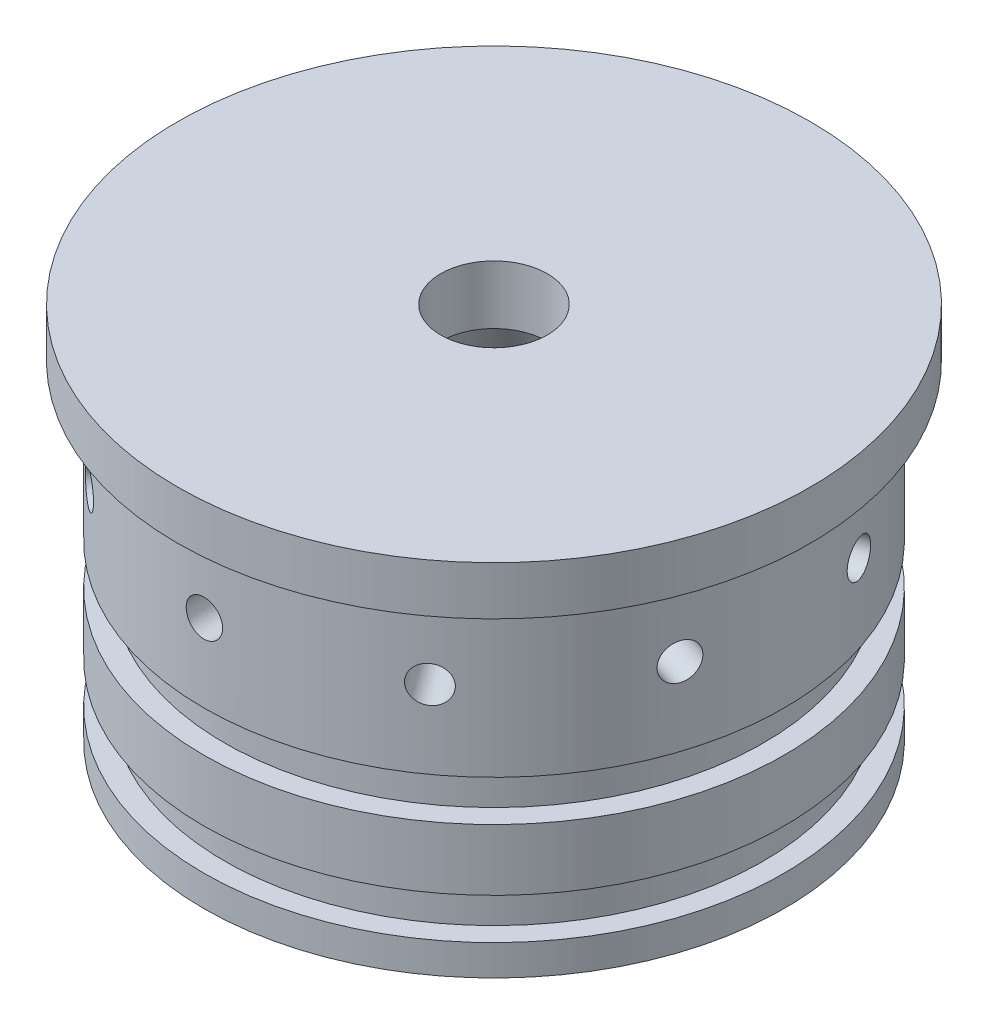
SolidWorks part; units mm, degrees
ref_plane "Front Plane" through (0, 0, 0) normal (0, 0, 1) x (1, 0, 0)
ref_plane "Top Plane" through (0, 0, 0) normal (0, 1, 0) x (1, 0, 0)
ref_plane "Right Plane" through (0, 0, 0) normal (1, 0, 0) x (0, 0, -1)
sketch "Sketch1" plane through (0, 0, 0) normal (0, 0, 1) x (1, 0, 0)
  line L0 (0, 0) -> (0, 39.8554) construction
  line L1 (26.7335, 0) -> (37.846, 0)
  line L2 (37.846, 0) -> (37.846, 4)
  line L4 (37.846, 13.334) -> (37.846, 17.334)
  line L5 (37.846, 42.988) -> (41.275, 42.988)
  line L6 (41.275, 42.988) -> (41.275, 49.338)
  line L7 (41.275, 49.338) -> (6.9453, 49.338)
  line L8 (0, 49.338) -> (0, 39.8554)
  line L9 (37.846, 0) -> (37.846, 4)
  line L10 (37.846, 4) -> (35.1282, 4)
  line L11 (35.1282, 4) -> (35.1282, 9.334)
  line L12 (35.1282, 9.334) -> (37.846, 9.334)
  line L13 (37.846, 9.334) -> (37.846, 13.334)
  line L14 (37.846, 13.334) -> (37.846, 17.334)
  line L15 (37.846, 17.334) -> (35.1282, 17.334)
  line L16 (35.1282, 17.334) -> (35.1282, 22.668)
  line L17 (35.1282, 22.668) -> (37.846, 22.668)
  line L18 (37.846, 22.668) -> (37.846, 42.988)
  line L19 (37.846, 0) -> (26.7335, 0)
  line L20 (26.7335, 0) -> (26.7335, 12.7)
  line L22 (26.7335, 12.7) -> (20.3835, 12.7)
  line L24 (6.9453, 49.338) -> (6.9453, 41.6954)
  line L25 (6.9453, 41.6954) -> (20.3835, 12.7)
  point P3 (0, 0)
  point P24 (0, 0)
  point P25 (-4.9808, 15.6745)
  point P26 (0, 0)
  point P27 (0, 0)
  dimension "D2" = 41.275
  dimension "D3" = 20.32
  dimension "D4" = 3.429
  dimension "D5" = 5.334
  dimension "D6" = 4
  dimension "D7" = 4
  dimension "D8" = 4
  dimension "D9" = 5.334
  dimension "D10" = 2.7178
  dimension "D11" = 2.7178
  dimension "D12" = 6.35
  dimension "D13" = 39.8554
  dimension "D14" = 12.7
  dimension "D15" = 6.9453
  dimension "D16" = 26.7335
  dimension "D17" = 41.6954
revolve "Revolve1" add sketch "Sketch1" angle 360 about L0
sketch "Sketch2" plane through (0, 0, 0) normal (0, 0, 1) x (1, 0, 0)
  line L0 (0, 0) -> (0, 22.668)
  line L1 (-37.846, 0) -> (37.846, 0) construction
  line L2 (-35.1282, 22.668) -> (35.1282, 22.668) construction
  line L3 (0, 22.668) -> (0, 42.988)
  line L4 (-37.846, 42.988) -> (37.846, 42.988) construction
  circle A0 centre (0, 32.828) radius 2.3812
  point P11 (0, 30.4467)
  dimension "D1" = 4.7625
ref_plane "Plane1" through (0, 0, 37.846) normal (0, 0, 1) x (1, 0, 0)
sketch "Sketch3" plane through (0, 0, 37.846) normal (0, 0, 1) x (1, 0, 0)
  circle A0 centre (0, 32.828) radius 2.3749
  dimension "D1" = 4.7498
extrude "Cut-Extrude2" cut sketch "Sketch3" against normal blind 12.7
pattern_circular "CirPattern1" count 10 over 360 about axis through (0, 0, 0) along (0, 1, 0) of "Cut-Extrude2"
